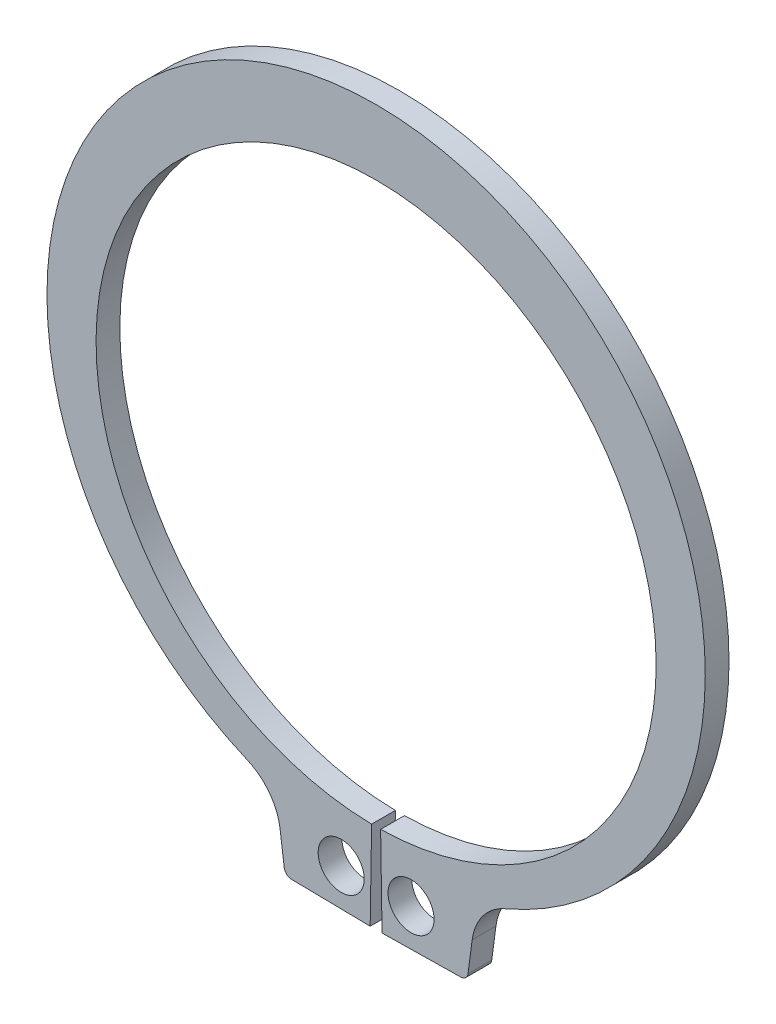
SolidWorks part; units mm, degrees
ref_plane "Plane1" through (0, 0, 0) normal (0, 0, 1) x (1, 0, 0)
ref_plane "Plane2" through (0, 0, 0) normal (0, 1, 0) x (1, 0, 0)
ref_plane "Plane3" through (0, 0, 0) normal (1, 0, 0) x (0, 0, -1)
sketch "Clipboard" plane through (0, 0, 0) normal (0, 0, 1) x (1, 0, 0)
  line L0 (0, 0) -> (4.4, 0)
  line L1 (0, 0) -> (0, 2.3)
  line L2 (0, 0) -> (0, -6)
  circle A0 centre (0, 0) radius 1.55
  circle A1 centre (0, 0) radius 20
  dimension "HoleDia" = 3.1
  dimension "ShaftDia" = 40
  dimension "LargeSection" = 4.4
  dimension "SmallSection" = 2.3
  dimension "LugSection" = 6
sketch "BodySke" plane through (0, 0, 0) normal (0, 0, 1) x (1, 0, 0)
  line L0 (-1.5431, 0) -> (1.5431, 0) construction
  line L1 (0, 0) -> (0, 23.25) construction
  line L2 (0.3034, -18.8476) -> (0.4, -24.8468)
  line L3 (-0.3034, -18.8476) -> (-0.4, -24.8468)
  line L4 (0, 0) -> (10.1316, -22.6908) construction
  line L5 (0, 0) -> (-10.1316, -22.6908) construction
  line L6 (0.4, -24.8468) -> (5.6973, -24.7615)
  line L7 (6.4639, -22.2079) -> (6.185, -24.3268)
  line L8 (-6.4639, -22.2079) -> (-6.185, -24.3268)
  line L9 (-0.4, -24.8468) -> (-5.6973, -24.7615)
  circle A0 centre (0, 0) radius 18.85 construction
  arc A1 (0.3034, -18.8476) -> (-0.3034, -18.8476) centre (0, 0) ccw
  arc A2 (8.6231, -19.3123) -> (-8.6231, -19.3123) centre (0, 1.0953) ccw construction
  arc A3 (0.4, -24.8468) -> (6.2229, -24.0582) centre (0, 0) ccw construction
  arc A4 (8.6819, -19.2873) -> (6.4639, -22.2079) centre (10.1316, -22.6908) ccw
  arc A5 (-6.4639, -22.2079) -> (-8.6819, -19.2873) centre (-10.1316, -22.6908) ccw
  arc A6 (-6.2229, -24.0582) -> (-0.4, -24.8468) centre (0, 0) ccw construction
  arc A7 (8.6819, -19.2873) -> (-8.6819, -19.2873) centre (0, 1.0953) ccw
  arc A8 (-6.5647, -21.4426) -> (6.5647, -21.4426) centre (0, 0) ccw construction
  circle A9 centre (2.35, -22.3015) radius 1.55
  circle A10 centre (-2.35, -22.3015) radius 1.55
  arc A11 (6.185, -24.3268) -> (5.6973, -24.7615) centre (5.6892, -24.2616) cw
  arc A12 (-6.185, -24.3268) -> (-5.6973, -24.7615) centre (-5.6892, -24.2616) ccw
  point P28 (6.2202, -24.0589)
  point P31 (-6.2202, -24.0589)
  dimension "GrooveDia" = 37.7
  dimension "D3" = 0.5
  dimension "LugRad" = 24.85
  dimension "HoleOffsetRad" = 22.425
  dimension "HoleDia" = 3.1
  dimension "D2" = 15
  dimension "LargeRad" = 23.25
  dimension "SmallRad" = 21.15
  dimension "Gap" = 0.8
  dimension "SmallAngle" = 48.122
  dimension "HoleSpacing" = 4.7
extrude "Body" add sketch "BodySke" against normal mid plane 1.6
sketch "NotSke" plane through (0, 0, 0.8) normal (0, 0, 1) x (1, 0, 0)
  line L0 (2.35, -20.7515) -> (2.35, -23.8515)
  line L1 (2.35, -23.8515) -> (-2.35, -23.8515)
  line L2 (-2.35, -23.8515) -> (-2.35, -20.7515)
  line L3 (-2.35, -20.7515) -> (2.35, -20.7515)
  circle A0 centre (2.35, -22.3015) radius 1.55 construction
  circle A1 centre (-2.35, -22.3015) radius 1.55 construction
extrude "Notch" cut sketch "NotSke" against normal through all
equation "' \"ShaftDia@Clipboard\" = 4"
equation "' \"Thickness@Body\" = 0.25"
equation "' \"GrooveDia@BodySke\" = 3.8"
equation "' \"LugSection@Clipboard\" = 1.35"
equation "' \"LargeSection@Clipboard\" = 0.65"
equation "' \"SmallSection@Clipboard\" = 0.4"
equation "' \"HoleDia@Clipboard\" = 0.6"
equation "' \"ShaftDia@Clipboard\" = 15"
equation "' \"Thickness@Body\" = 0.9"
equation "' \"GrooveDia@BodySke\" = 14.15"
equation "' \"LugSection@Clipboard\" = 2.8"
equation "' \"LargeSection@Clipboard\" = 1.8"
equation "' \"SmallSection@Clipboard\" = 1.05"
equation "' \"HoleDia@Clipboard\" = 1.2"
equation "\"Gap@BodySke\" =  \"Thickness@Body\" / 2"
equation "\"LargeRad@BodySke\" =  \"GrooveDia@BodySke\" / 2 +  \"LargeSection@Clipboard\""
equation "\"SmallRad@BodySke\" =  \"GrooveDia@BodySke\" / 2 +  \"SmallSection@Clipboard\""
equation "\"LugRad@BodySke\" = \"GrooveDia@BodySke\" / 2 + \"LugSection@Clipboard\""
equation "\"HoleOffsetRad@BodySke\" = (  \"ShaftDia@Clipboard\" / 2 + \"LugRad@BodySke\" ) / 2"
equation "\"HoleSpacing@BodySke\" = \"Gap@BodySke\"  * 2 +  \"HoleDia@Clipboard\""
equation "\"HoleDia@BodySke\" =  \"HoleDia@Clipboard\""
equation "\"SmallAngle@BodySke\" = atn(\"HoleSpacing@BodySke\" / 2 / sqr(\"HoleOffsetRad@BodySke\"  * \"HoleOffsetRad@BodySke\" - (\"HoleSpacing@BodySke\" / 2) * (\"HoleSpacing@BodySke\" / 2) ))  * 8 * ( 180 / 3.141593)"
